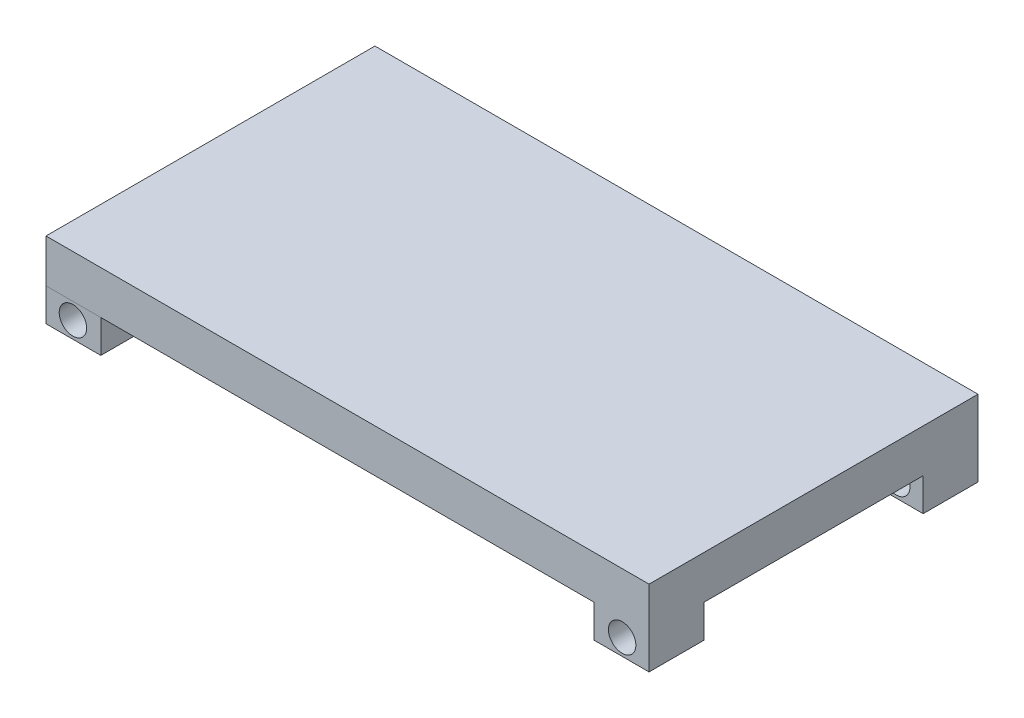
SolidWorks part; units mm, degrees
ref_plane "Front Plane" through (0, 0, 0) normal (0, 0, 1) x (1, 0, 0)
ref_plane "Top Plane" through (0, 0, 0) normal (0, 1, 0) x (1, 0, 0)
ref_plane "Right Plane" through (0, 0, 0) normal (1, 0, 0) x (0, 0, -1)
sketch "Sketch2" plane through (0, 0, 0) normal (0, 0, 1) x (1, 0, 0)
  line L1 (0, 0) -> (139.7, 0)
  line L2 (0, 0) -> (0, 10)
  line L3 (0, 10) -> (139.7, 10)
  line L4 (139.7, 0) -> (139.7, 10)
  dimension "D1" = 139.7
  dimension "D2" = 10
extrude "Boss-Extrude1" add sketch "Sketch2" against normal blind 76.2
sketch "Sketch3" plane through (0, 10, 0) normal (0, 1, 0) x (1, 0, 0)
  line L0 (69.85, 76.2) -> (69.85, -2.4476) construction
  line L1 (139.7, 76.2) -> (0, 76.2) construction
  line L2 (0, 38.1) -> (142.3076, 38.1) construction
  line L3 (0, 76.2) -> (0, 0) construction
  line L5 (69.85, 20.1395) -> (87.8105, 38.1)
  line L6 (69.85, 20.1395) -> (51.8895, 38.1)
  line L7 (51.8895, 38.1) -> (69.85, 56.0605)
  line L8 (87.8105, 38.1) -> (69.85, 56.0605)
  point P8 (69.85, 38.1)
  dimension "D1" = 25.4
  dimension "D2" = 25.4
ref_plane "Plane3" through (0, 0, -50.8) normal (0, 0, -1) x (-1, 0, 0)
sketch "Sketch4" plane through (0, 0, 0) normal (0, -1, 0) x (1, 0, 0)
  line L1 (0, 0) -> (12.7, 0)
  line L2 (0, 0) -> (0, -12.7)
  line L3 (0, -12.7) -> (12.7, -12.7)
  line L4 (12.7, 0) -> (12.7, -12.7)
  dimension "D1" = 12.7
  dimension "D2" = 12.7
extrude "Boss-Extrude5" add sketch "Sketch4" along normal blind 7.62 separate body
sketch "Sketch5" plane through (0, 0, 0) normal (0, 0, 1) x (1, 0, 0)
  line L0 (12.7, -7.62) -> (0, -7.62) construction
  circle A0 centre (6.2344, -3.81) radius 3.175
  dimension "D1" = 6.35
  dimension "D2" = 3.81
extrude "Cut-Extrude1" cut sketch "Sketch5" against normal up to next
ref_plane "Plane4" through (0, 0, -38.1) normal (0, 0, 1) x (1, 0, 0)
mirror "Mirror2" about plane through (0, 0, -38.1) normal (0, 0, 1)
ref_plane "Plane5" through (69.85, 0, 0) normal (1, 0, 0) x (0, 0, -1)
mirror "Mirror4" about plane through (69.85, 0, 0) normal (1, 0, 0) of "Boss-Extrude5", "Cut-Extrude1", "Mirror2"
